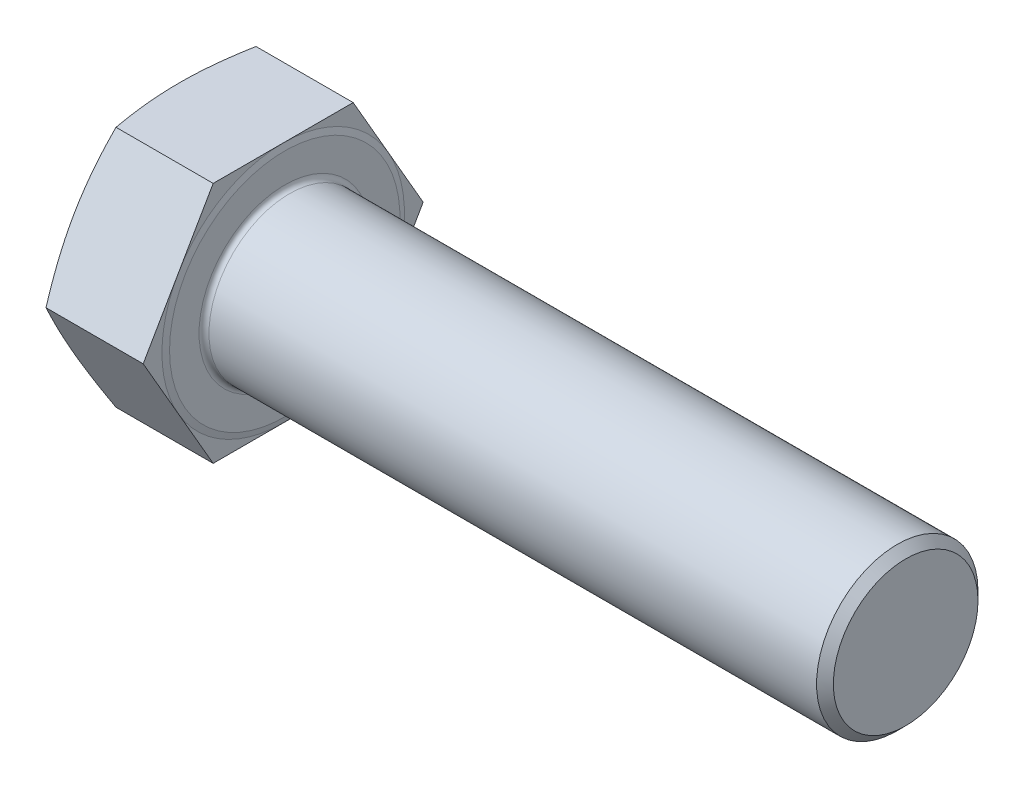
SolidWorks part; units mm, degrees
ref_plane "Front" through (0, 0, 0) normal (0, 0, 1) x (1, 0, 0)
ref_plane "Top" through (0, 0, 0) normal (0, 1, 0) x (1, 0, 0)
ref_plane "Right" through (0, 0, 0) normal (1, 0, 0) x (0, 0, -1)
sketch "Sketch-BaseHead" plane through (0, 0, 0) normal (1, 0, 0) x (0, 0, -1)
  line L1 (45.0911, 0) -> (22.5455, 39.05)
  line L2 (22.5455, 39.05) -> (-22.5455, 39.05)
  line L3 (-22.5455, 39.05) -> (-45.0911, 0)
  line L4 (-45.0911, 0) -> (-22.5455, -39.05)
  line L5 (-22.5455, -39.05) -> (22.5455, -39.05)
  line L6 (22.5455, -39.05) -> (45.0911, 0)
  circle A0 centre (0, 0) radius 39.05 construction
  dimension "s" = 78.1
extrude "BaseHead" add sketch "Sketch-BaseHead" along normal blind 33.5
sketch "Sketch4" plane through (-0.2646, 0, 5.9169) normal (0, 1, 0) x (0, 0, -1)
  line L0 (5.9169, 3.7369) -> (5.9169, -10.4477) construction
  line L2 (51.008, -0.2646) -> (44.9669, -0.2646)
  line L4 (44.9669, -0.2646) -> (51.008, -2.4634)
  line L6 (51.008, -2.4634) -> (51.008, -0.2646)
  dimension "D1" = 20
  dimension "D2" = 78.1
revolve "HeadChamfer" cut sketch "Sketch4" angle 360 about L0
sketch "Sketch1" plane through (0, 0, 0) normal (0, 0, 1) x (1, 0, 0)
  line L0 (33.5, 0) -> (34, 0)
  line L1 (34, 0) -> (34, -37.1)
  line L2 (34, -37.1) -> (33.5, -39.05)
  line L3 (33.5, -39.05) -> (33.5, 0) construction
  line L4 (0, 0) -> (7.5821, 0) construction
  line L5 (-4.0016, 0) -> (10.1831, 0) construction
  line L6 (33.5, -39.05) -> (2.1988, -39.05) construction
  line L7 (33.5, 0) -> (33.5, -39.05)
  dimension "D1" = 39.05
  dimension "c" = 0.5
  dimension "D2" = 37.1
revolve "Revolve1" add sketch "Sketch1" angle 360 about axis through (-4.0016, 0, 0) along (1, 0, 0)
ref_plane "Plane2" through (118, 0, 0) normal (1, 0, 0) x (0, 0, -1)
sketch "Sketch3" plane through (34, 0, 0) normal (1, 0, 0) x (0, 0, -1)
  circle A0 centre (0, 0) radius 26
  dimension "d" = 52
extrude "BaseBody" add sketch "Sketch3" along normal blind 200
fillet "HeadFillet" radius 1.6 1 edges at (34, 0, -26)
chamfer "Chamfer1" distance 2.7065 angle 45 1 edges at (234, 0, -26)
equation "\"D1@Sketch1\" = \"s@Sketch-BaseHead\"/ 2"
equation "\"D2@Sketch4\" = \"s@Sketch-BaseHead\""
equation "\"D1@Chamfer1\" =  ( \"d@Sketch3\" - \"D2@ThreadCosmetic1\" ) / 2 "
equation "\"b@ThreadCosmetic1\" = \"l@BaseBody\" - \"lg@Plane2\""
